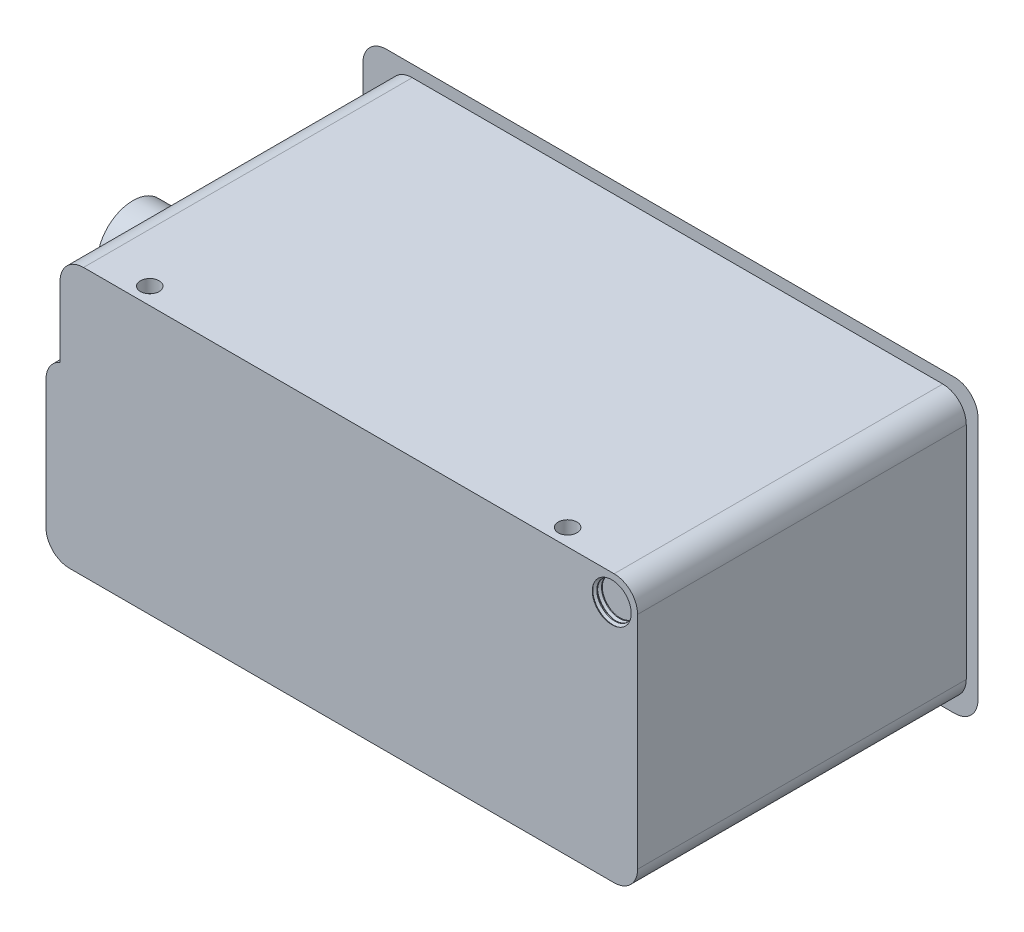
SolidWorks part; units mm, degrees
ref_plane "Front" through (0, 0, 0) normal (0, 0, 1) x (1, 0, 0)
ref_plane "Top" through (0, 0, 0) normal (0, 1, 0) x (1, 0, 0)
ref_plane "Right" through (0, 0, 0) normal (1, 0, 0) x (0, 0, -1)
sketch "Sketch1" plane through (0, 0, 0) normal (0, 0, 1) x (1, 0, 0)
  line L0 (-83.185, -39.37) -> (83.185, 39.37) construction
  line L1 (-83.185, 39.37) -> (83.185, 39.37)
  line L2 (-83.185, 39.37) -> (-83.185, -39.37)
  line L3 (-83.185, -39.37) -> (83.185, -39.37)
  line L4 (83.185, 39.37) -> (83.185, -39.37)
  dimension "D1" = 78.74
  dimension "D2" = 166.37
extrude "Base-Extrude" add sketch "Sketch1" along normal blind 92.075
fillet "Fillet2" radius 6.35 4 edges at (-83.185, 39.37, 46.0375) (83.185, 39.37, 46.0375) (83.185, -39.37, 46.0375) (-83.185, -39.37, 46.0375)
other "Cavity15"
other "Flat Head Phillips (U.S.)<2>@Motor Control Box"
other "Flat Head Phillips (U.S.)<1>@Motor Control Box"
other "Socket Head Cap Screws (U.S.)<17>@Motor Control Box"
other "Socket Head Cap Screws (U.S.)<15>@Motor Control Box"
other "Socket Head Cap Screws (U.S.)<13>@Motor Control Box"
other "Socket Head Cap Screws (U.S.)<12>@Motor Control Box"
other "Socket Head Cap Screws (U.S.)<11>@Motor Control Box"
other "Socket Head Cap Screws (U.S.)<10>@Motor Control Box"
other "Socket Head Cap Screws (U.S.)<9>@Motor Control Box"
other "Socket Head Cap Screws (U.S.)<8>@Motor Control Box"
other "Socket Head Cap Screws (U.S.)<7>@Motor Control Box"
other "Socket Head Cap Screws (U.S.)<6>@Motor Control Box"
other "Socket Head Cap Screws (U.S.)<5>@Motor Control Box"
other "Socket Head Cap Screws (U.S.)<4>@Motor Control Box"
other "Socket Head Cap Screws (U.S.)<3>@Motor Control Box"
other "Socket Head Cap Screws (U.S.)<2>@Motor Control Box"
other "Spacer 4-40<8>@Motor Control Box"
other "Spacer 4-40<7>@Motor Control Box"
other "Spacer 4-40<6>@Motor Control Box"
other "Capacitor Bank Rev2<1>@Motor Control Box"
other "SWAGELOK-810-1-8ST<1>@Motor Control Box"
other "Spacer 4-40<2>@Motor Control Box"
other "Spacer 4-40<1>@Motor Control Box"
other "Driver Board Heatsink<1>@Motor Control Box-"
other "Driver Board Bracket<2>@Motor Control Box-"
other "Driver Board Bracket<1>@Motor Control Box-"
other "ELMO Bracket Bottom<1>@Motor Control Box-"
other "SWAGELOK-810-2-8ST<3>@Motor Control Box-"
other "SWAGELOK-810-2-8ST<2>@Motor Control Box-"
other "SWAGELOK-810-2-8ST<1>@Motor Control Box-"
other "MINK-BCR-WASHER<2>@Motor Control Box-"
other "MINK-BCR-NUT<2>@Motor Control Box-"
other "MINK-BCR-L<2>@Motor Control Box-"
other "Motor Control Box Lid<1>@Motor Control Box-"
other "Driver Board<1>@Motor Control Box-15"
other "Motor Control Enclosure<1>@Motor Control Box-15"
other "Hex Plug SAE 7-16-20<2>@Motor Control Box-8"
other "Hex Plug SAE 7-16-20<1>@Motor Control Box-8"
other "Spacer 4-40<5>@Motor Control Box-11"
other "Motor Control Box Lid<2>@Motor Control Box-11"
other "ELMO Assm<1>@Motor Control Box/PWM board<1>@ELMO Assm-1"
other "ELMO Assm<1>@Motor Control Box/ELMO PCB Base<1>@ELMO Assm-1"
